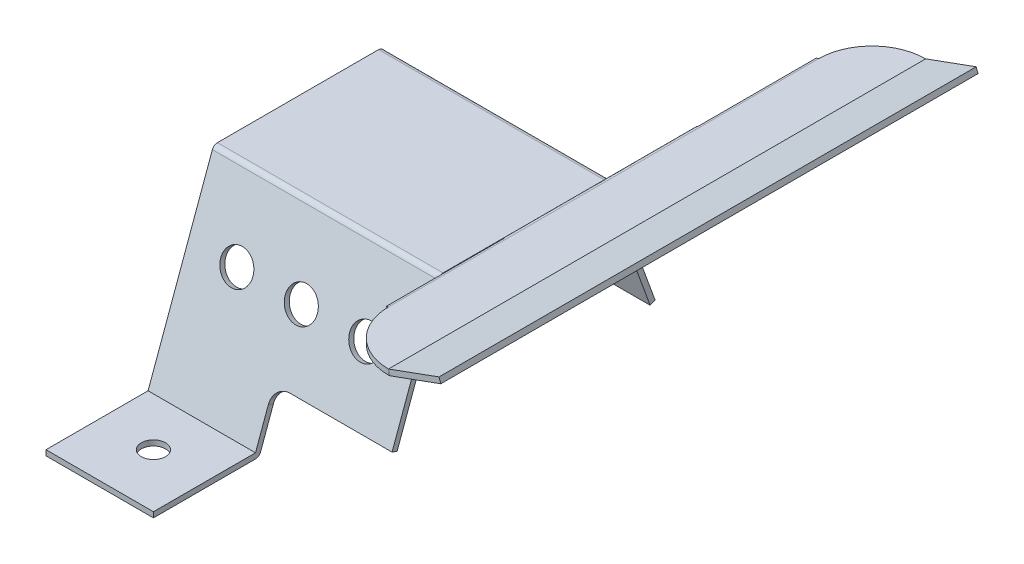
SolidWorks part; units mm, degrees
ref_plane "Front Plane" through (0, 0, 0) normal (0, 0, 1) x (1, 0, 0)
ref_plane "Top Plane" through (0, 0, 0) normal (0, 1, 0) x (1, 0, 0)
ref_plane "Right Plane" through (0, 0, 0) normal (1, 0, 0) x (0, 0, -1)
sketch "Sketch1" plane through (0, 0, 0) normal (0, 1, 0) x (1, 0, 0)
  line L0 (0, 0) -> (82, 0) construction
  line L1 (0, -15) -> (0, 15)
  line L2 (0, 15) -> (59, 15)
  line L3 (62, 18) -> (62, 40)
  line L4 (72, 50) -> (82, 50)
  line L5 (82, 50) -> (82, -50)
  line L6 (59, 3) -> (45, 3)
  line L7 (45, -3) -> (59, -3)
  line L8 (0, -15) -> (59, -15)
  line L9 (62, -18) -> (62, -40)
  line L10 (72, -50) -> (82, -50)
  arc A0 (62, 40) -> (72, 50) centre (72, 40) cw
  arc A1 (59, -3) -> (59, 3) centre (59, 0) ccw
  arc A2 (45, 3) -> (45, -3) centre (45, 0) ccw
  arc A3 (59, 15) -> (62, 18) centre (59, 18) ccw
  arc A4 (59, -15) -> (62, -18) centre (59, -18) cw
  arc A5 (62, -40) -> (72, -50) centre (72, -40) ccw
  dimension "D2" = 10
  dimension "D6" = 6
  dimension "D7" = 3
  dimension "D8" = 14
  dimension "D9" = 3
  dimension "D1" = 82
  dimension "D3" = 20
  dimension "D4" = 15
  dimension "D5" = 50
sheet metal parameters "Sheet-Metal1" thickness 1 parameters "D1"=0.0001
base flange "Base-Flange1" sketch "Sketch1" thickness 1 reverse thickness direction yes parameters "D1"=0.0001
sketch "Sketch3" plane through (0, 1, 0) normal (0, 1, 0) x (1, 0, 0)
  line L0 (72, 50) -> (72, -50)
sketched bend "Sketched Bend2" parameters "D1"=0.001
bend "SketchBend2" bend radius 0.001 bend angle 20 parameters "D5"=1
sketch "Sketch4" plane through (0, 1, 0) normal (0, 1, 0) x (1, 0, 0)
  line L0 (42, 15) -> (42, -15)
  line L1 (0, 15) -> (59, 15) construction
  line L2 (0, -15) -> (59, -15) construction
  line L4 (62, 40) -> (62, 18) construction
  dimension "D1" = 20
sketched bend "Sketched Bend4" parameters "D1"=0.001
bend "SketchBend5" bend radius 0.001 bend angle 45 parameters "D5"=2
sketch "Sketch5" plane through (20.5, -20.5, 0) normal (-0.7071, 0.7071, 0) x (0, 0, 1)
  line L0 (-18, 50.4056) -> (18, 50.4056)
sketched bend "Sketched Bend5" parameters "D1"=0.001
bend "SketchBend7" bend radius 0.0001 bend angle 45 parameters "D5"=3
sketch "Sketch6" plane through (0, 0, 0) normal (-1, 0, 0) x (0, 0, 1)
  line L0 (15, 0) -> (26.9707, -32.8892)
  line L1 (15, 0) -> (15, 1)
  line L2 (0, 0) -> (0, -22.7073) construction
  line L3 (16, 0.1763) -> (27.9104, -32.5472) construction
  line L4 (15.9397, 0.342) -> (27.9104, -32.5472)
  line L5 (16, 0.1763) -> (16, 1) construction
  line L6 (-15, 0) -> (15, 0) construction
  line L7 (26.9707, -32.8892) -> (27.9104, -32.5472)
  line L8 (-26.9707, -32.8892) -> (-27.9104, -32.5472)
  line L9 (-15, 0) -> (-26.9707, -32.8892)
  line L10 (-15.9397, 0.342) -> (-27.9104, -32.5472)
  line L11 (-15, 0) -> (-15, 1)
  arc A0 (15.9397, 0.342) -> (15, 1) centre (15, 0) ccw
  arc A1 (-15.9397, 0.342) -> (-15, 1) centre (-15, 0) cw
  dimension "D2" = 110
  dimension "D3" = 35
  dimension "D1" = 1
extrude "Extrude1" add sketch "Sketch6" against normal blind 42
sketch "Sketch7" plane through (0, 5.1629, 14.185) normal (0, 0.342, 0.9397) x (1, 0, 0)
  line L0 (0, -40.1303) -> (0, -5.1303) construction
  line L1 (42, -5.1303) -> (0, -5.1303) construction
  line L3 (42, -40.1303) -> (20, -40.1303)
  line L4 (42, -40.1303) -> (42, -30.1303)
  line L5 (42, -30.1303) -> (23, -30.1303)
  line L6 (20, -40.1303) -> (20, -33.1303)
  circle A0 centre (9, -18.1303) radius 3
  circle A1 centre (21, -18.1303) radius 3
  circle A2 centre (33, -18.1303) radius 3
  arc A3 (20, -33.1303) -> (23, -30.1303) centre (23, -33.1303) cw
  dimension "D1" = 6
  dimension "D2" = 9
  dimension "D3" = 12
  dimension "D4" = 12
  dimension "D5" = 13
  dimension "D8" = 3
  dimension "D6" = 20
  dimension "D7" = 25
extrude "Extrude3" cut sketch "Sketch7" against normal blind 12
mirror "Mirror1" about plane through (0, 0, 0) normal (0, 0, 1) of "Extrude3"
sketch "Sketch8" plane through (0, 0, 0) normal (-1, 0, 0) x (0, 0, 1)
  line L0 (-27.9104, -33.5472) -> (-46.9104, -33.5472)
  line L1 (27.9104, -33.5472) -> (46.9104, -33.5472)
  line L2 (26.9707, -32.8892) -> (27.9104, -32.5472)
  line L3 (27.9104, -32.5472) -> (46.9104, -32.5472)
  line L4 (46.9104, -32.5472) -> (46.9104, -33.5472)
  line L5 (0, 0) -> (0, -41.5964) construction
  line L6 (0, -28.4595) -> (0, 28.4595) construction
  line L7 (-26.9707, -32.8892) -> (-27.9104, -32.5472)
  line L8 (-27.9104, -32.5472) -> (-46.9104, -32.5472)
  line L9 (-46.9104, -32.5472) -> (-46.9104, -33.5472)
  arc A0 (26.9707, -32.8892) -> (27.9104, -33.5472) centre (27.9104, -32.5472) ccw
  arc A1 (-26.9707, -32.8892) -> (-27.9104, -33.5472) centre (-27.9104, -32.5472) cw
  dimension "D1" = 19
extrude "Extrude4" add sketch "Sketch8" against normal blind 20
sketch "Sketch9" plane through (0, -32.5472, 0) normal (0, 1, 0) x (-1, 0, 0)
  line L0 (-20, -46.9104) -> (0, -46.9104) construction
  line L1 (-20, 46.9104) -> (0, 46.9104) construction
  line L2 (0, 46.9104) -> (0, 27.9104) construction
  line L3 (0, -27.9104) -> (0, -46.9104) construction
  circle A0 centre (-10, -37.0904) radius 2.25
  circle A1 centre (-10, 36.9104) radius 2.25
  dimension "D1" = 4.5
  dimension "D2" = 9.82
  dimension "D3" = 10
  dimension "D4" = 10
  dimension "D5" = 10
extrude "Extrude5" cut sketch "Sketch9" against normal blind 20
sketch "Sketch10" plane through (0, -32.5472, 0) normal (0, 1, 0) x (1, 0, 0)
  line L1 (0, 46.9104) -> (20, 46.9104)
  line L2 (0, 46.9104) -> (0, 47.0904)
  line L3 (0, 47.0904) -> (20, 47.0904)
  line L4 (20, 46.9104) -> (20, 47.0904)
  dimension "D1" = 0.18
extrude "Extrude6" add sketch "Sketch10" against normal blind 1
flat pattern "Flat-Pattern1"
sketch "Bend-Lines1" plane through (0, 0, 0) normal (0, 1, 0) x (-1, 0, 0)
bend of the flat pattern "Flatten-<SketchBend2>1"
bend of the flat pattern "Flatten-<SketchBend5>1"
bend of the flat pattern "Flatten-<SketchBend7>1"
